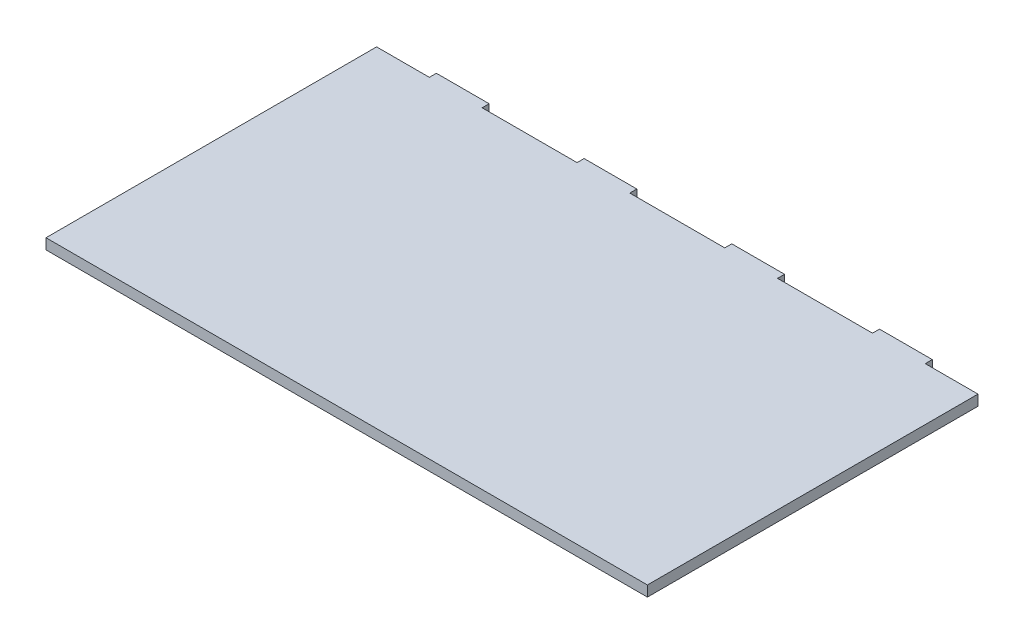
SolidWorks part; units mm, degrees
ref_plane "Front Plane" through (0, 0, 0) normal (0, 0, 1) x (1, 0, 0)
ref_plane "Top Plane" through (0, 0, 0) normal (0, 1, 0) x (1, 0, 0)
ref_plane "Right Plane" through (0, 0, 0) normal (1, 0, 0) x (0, 0, -1)
sketch "Sketch1" plane through (0, 0, 0) normal (0, 1, 0) x (1, 0, 0)
  line L0 (114, 4) -> (144, 4)
  line L1 (0, 0) -> (342, 0)
  line L2 (0, 0) -> (0, -188)
  line L3 (0, -188) -> (342, -188)
  line L4 (342, 0) -> (342, -188)
  line L5 (30, 0) -> (60, 0)
  line L6 (30, 0) -> (30, 4)
  line L7 (30, 4) -> (60, 4)
  line L8 (60, 0) -> (60, 4)
  line L9 (198, 4) -> (228, 4)
  line L10 (282, 4) -> (312, 4)
  line L11 (144, 0) -> (144, 4)
  line L12 (114, 0) -> (114, 4)
  line L13 (228, 0) -> (228, 4)
  line L14 (198, 0) -> (198, 4)
  line L15 (312, 0) -> (312, 4)
  line L16 (282, 0) -> (282, 4)
  line L17 (0, 0) -> (0, 8.1026) construction
  line L18 (0, 4) -> (30, 4) construction
  line L19 (342, 0) -> (342, 8) construction
  line L20 (342, 4) -> (312, 4) construction
extrude "Boss-Extrude1" add sketch "Sketch1" along normal blind 6 contours L4 L1 L2 L3 | L1 L8 L7 L6 | L12 L1 L11 L0 | L16 L1 L15 L10 | L14 L1 L13 L9
equation "\"sheetThickness\"=0.63mm"
equation "\"flange\"= 11mm"
equation "\"baffleCutWidth\"= 28.58mm"
equation "\"baffleCutLength\"= 146.22mm"
equation "\"metalLength\" = 156.28mm"
equation "\"metalWidth\" = 35.5mm"
equation "\"pitch\" = 42mm"
equation "\"cabDepth\" = 130mm "
equation "\"overallDepth\" = \"cabDepth\" + 58mm   "
equation "\"D1@Sketch1\"=8*\"pitch\"+6"
equation "\"D2@Sketch1\"=\"overallDepth\""
equation "\"D6@Sketch1\"=2*\"pitch\""
